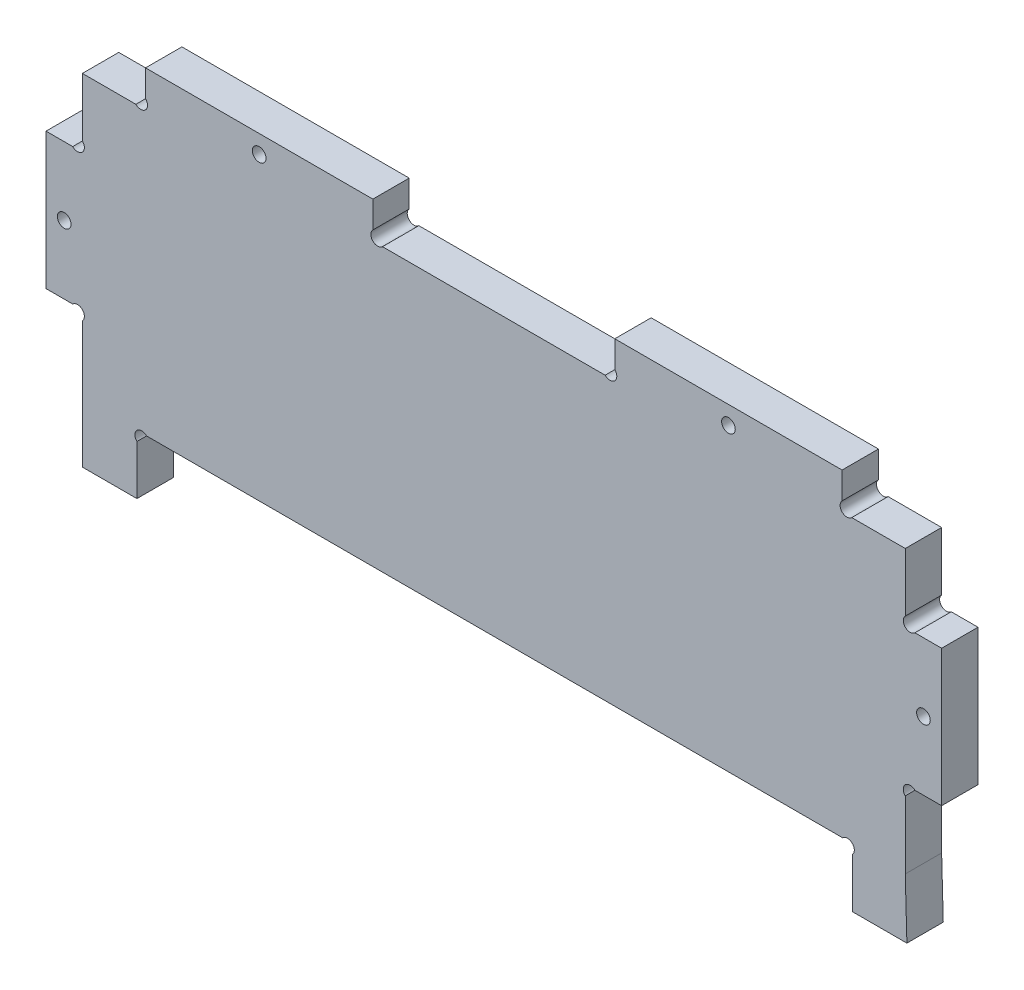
SolidWorks part; units mm, degrees
ref_plane "Plan de face" through (0, 0, 0) normal (0, 0, 1) x (1, 0, 0)
ref_plane "Plan de dessus" through (0, 0, 0) normal (0, 1, 0) x (1, 0, 0)
ref_plane "Plan de droite" through (0, 0, 0) normal (1, 0, 0) x (0, 0, -1)
sketch "Esquisse1" plane through (0, 0, 0) normal (0, 0, 1) x (1, 0, 0)
  line L0 (-17.9362, -36.5367) -> (135.18, -36.5367)
  line L1 (-20.0575, -36.5367) -> (0.4956, -57.0898) construction
  line L2 (-32.0575, -36.5367) -> (-32.0575, -21.658)
  line L3 (-34.1788, -19.5367) -> (-40.0575, -19.5367)
  line L4 (-40.0575, -19.5367) -> (-40.0575, 10.4633)
  line L5 (-40.0575, 10.4633) -> (-34.1788, 10.4633)
  line L6 (-32.0575, -36.5367) -> (-32.0575, -49.5367)
  line L7 (-32.0575, 12.5846) -> (-32.0575, 25.4633)
  line L8 (148.9425, 25.4633) -> (137.1707, 25.4633)
  line L9 (135.0494, 27.5846) -> (135.0494, 33.4633)
  line L10 (135.0494, 33.4633) -> (85.0493, 33.4633)
  line L11 (85.0493, 33.4633) -> (85.0493, 27.5846)
  line L12 (82.928, 25.4633) -> (33.957, 25.4633)
  line L13 (31.8357, 27.5846) -> (31.8357, 33.4633)
  line L14 (-32.0575, -49.5367) -> (-20.0575, -49.5367)
  line L15 (31.8357, 33.4633) -> (-18.1644, 33.4633)
  line L16 (-18.1644, 33.4633) -> (-18.1644, 27.5846)
  line L17 (-20.2857, 25.4633) -> (-32.0575, 25.4633)
  line L18 (148.9425, 25.4633) -> (148.9425, 12.5846)
  line L19 (151.0638, 10.4633) -> (156.9425, 10.4633)
  line L20 (156.9425, 10.4633) -> (156.9425, -19.5367)
  line L21 (156.9425, -19.5367) -> (151.0638, -19.5367)
  line L22 (148.9425, -21.658) -> (148.9425, -36.5367)
  line L23 (137.3013, -36.5367) -> (104.526, -69.312) construction
  line L26 (-18.1644, 25.4633) -> (-32.1706, 39.4695) construction
  line L27 (31.8357, 25.4633) -> (42.097, 35.7246) construction
  line L28 (85.0493, 25.4633) -> (73.0431, 37.4695) construction
  line L29 (135.0494, 25.4633) -> (146.0604, 36.4743) construction
  line L30 (151.0638, 12.5846) -> (158.2185, 19.7393) construction
  line L31 (148.9425, -19.5367) -> (160.9061, -31.5003) construction
  line L34 (-32.0575, -19.5367) -> (-41.0213, -28.5005) construction
  line L35 (-32.0575, 10.4633) -> (-41.3335, 19.7393) construction
  line L36 (-40.0575, 10.4633) -> (-32.0575, -19.5367) construction
  line L37 (-18.1644, 33.4633) -> (31.8357, 25.4633) construction
  line L38 (85.0493, 25.4633) -> (135.0494, 33.4633) construction
  line L39 (156.9425, 10.4633) -> (148.9425, -19.5367) construction
  line L40 (-20.0575, -49.5367) -> (-20.0575, -38.658)
  line L41 (148.9425, -36.5367) -> (149.3013, -49.5367)
  line L42 (149.3013, -49.5367) -> (137.3013, -49.5367)
  line L43 (137.3013, -49.5367) -> (137.3013, -38.658)
  arc A1 (-34.1788, 10.4633) -> (-32.0575, 12.5846) centre (-33.1182, 11.5239) ccw construction
  arc A2 (137.3013, -38.658) -> (135.18, -36.5367) centre (136.2406, -37.5974) ccw
  arc A3 (-17.9362, -36.5367) -> (-20.0575, -38.658) centre (-18.9968, -37.5974) ccw
  arc A5 (-20.2857, 25.4633) -> (-18.1644, 27.5846) centre (-19.2251, 26.5239) ccw
  arc A6 (31.8357, 27.5846) -> (33.957, 25.4633) centre (32.8963, 26.5239) ccw
  arc A7 (82.928, 25.4633) -> (85.0493, 27.5846) centre (83.9887, 26.5239) ccw
  arc A8 (135.0494, 27.5846) -> (137.1707, 25.4633) centre (136.1101, 26.5239) ccw
  arc A9 (148.9425, 12.5846) -> (151.0638, 10.4633) centre (150.0032, 11.5239) ccw
  arc A10 (151.0638, -19.5367) -> (148.9425, -21.658) centre (150.0032, -20.5974) ccw
  arc A13 (-32.0575, -21.658) -> (-34.1788, -19.5367) centre (-33.1182, -20.5974) ccw
  arc A14 (-34.1788, 10.4633) -> (-32.0575, 12.5846) centre (-33.1182, 11.5239) ccw
  circle A15 centre (6.8356, 29.4633) radius 1.5
  circle A16 centre (110.0494, 29.4633) radius 1.5
  circle A17 centre (152.9425, -4.5367) radius 1.5
  circle A18 centre (-36.0575, -4.5367) radius 1.5
  dimension "D3" = 45
  dimension "D7" = 45
  dimension "D2" = 45
  dimension "D1" = 45
  dimension "D9" = 45
  dimension "D6" = 45
  dimension "D11" = 12
  dimension "D4" = 45
  dimension "D5" = 45
  dimension "D8" = 45
  dimension "D10" = 45
  dimension "D12" = 12
extrude "Boss.-Extru.1" add sketch "Esquisse1" along normal blind 8
